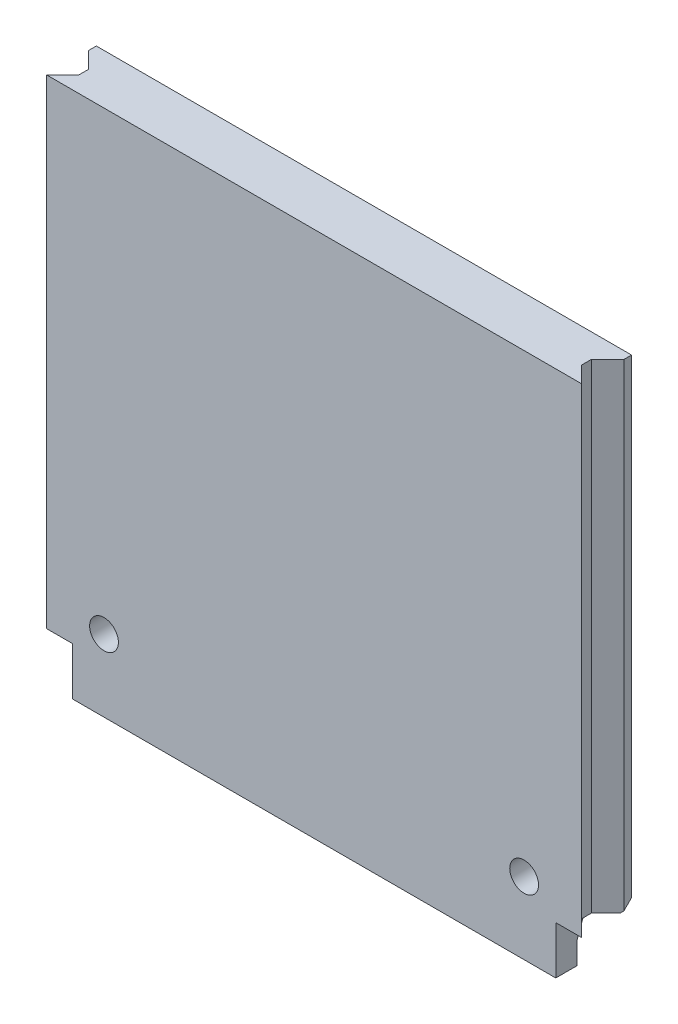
SolidWorks part; units mm, degrees
ref_plane "Alzado" through (0, 0, 0) normal (0, 0, 1) x (1, 0, 0)
ref_plane "Planta" through (0, 0, 0) normal (0, 1, 0) x (1, 0, 0)
ref_plane "Vista lateral" through (0, 0, 0) normal (1, 0, 0) x (0, 0, -1)
sketch "Sketch2" plane through (0, 0, 0) normal (0, 1, 0) x (1, 0, 0)
  line L0 (-60.5836, 0) -> (27.3127, 0) construction
  line L1 (-27.9, -2.2) -> (27.9, -2.2)
  line L2 (-28.8873, 0.5) -> (27.3127, 0.5) construction
  line L3 (-28.4873, -0.5) -> (28.5, -0.5) construction
  line L4 (-27.9, -2.2) -> (-26.2, -0.5)
  line L5 (-26.2, -0.5) -> (-26.2, 0.5)
  line L6 (-26.2, 0.5) -> (-27.9, 2.2)
  line L7 (-27.9, -2.2) -> (-27.9, -1.7267) construction
  line L8 (-27.9, 2.2) -> (-27.9, 3)
  line L9 (-27.9, 3) -> (27.9, 3)
  line L10 (0, -2.2) -> (0, 3) construction
  line L11 (0, 0) -> (0, 5.7662) construction
  line L12 (27.9, -2.2) -> (26.2, -0.5)
  line L13 (26.2, -0.5) -> (26.2, 0.5)
  line L14 (26.2, 0.5) -> (27.9, 2.2)
  line L15 (27.9, 2.2) -> (27.9, 3)
  dimension "D1" = 27.9
  dimension "D2" = 0.5
  dimension "D3" = 0.5
  dimension "D4" = 45
  dimension "D5" = 1.7
  dimension "D6" = 2.5
  dimension "D7" = 1.7
extrude "Boss-Extrude1" add sketch "Sketch2" along normal blind 50
chamfer "Chamfer1" distance 1 angle 45 1 edges at (0, 0, -3)
sketch "Sketch3" plane through (0, 0, 0) normal (0, -1, 0) x (1, 0, 0)
  line L0 (0, -3) -> (0, 2.2) construction
  line L1 (27.9, -3) -> (-27.9, -3) construction
  line L2 (-27.9, 2.2) -> (27.9, 2.2) construction
  line L3 (-25.2023, 2.2) -> (25.2, 2.2)
  line L4 (25.2, 2.2) -> (25.2, -1)
  line L5 (25.2, -1) -> (-25.2023, -1)
  line L6 (-25.2023, -1) -> (-25.2023, 2.2)
  line L7 (-26.2, -0.5) -> (-26.2, 0.5) construction
  line L8 (26.2, 0.5) -> (26.2, -0.5) construction
  point P12 (-26.2, 0)
  dimension "D1" = 0.9977
  dimension "D2" = 1
  dimension "D3" = 2
extrude "Boss-Extrude2" add sketch "Sketch3" along normal blind 5
sketch "Sketch4" plane through (-25.2023, 0, 0) normal (-1, 0, 0) x (0, 0, 1)
  line L0 (-1, 0) -> (0, -2.7475)
  line L1 (0, -2.7475) -> (0, -5)
  line L2 (2.2, -5) -> (-1, -5) construction
  line L3 (0, -5) -> (-1, -5)
  line L4 (-1, -5) -> (-1, 0)
  dimension "D1" = 20
extrude "Cut-Extrude1" cut sketch "Sketch4" against normal through all
sketch "Sketch5" plane through (0, 0, -3) normal (0, 0, -1) x (-1, 0, 0)
  line L0 (-27.9, 6) -> (27.9, 6) construction
  line L1 (-27.9, 50) -> (-27.9, 1) construction
  line L2 (27.9, 50) -> (27.9, 1) construction
  line L3 (-27.9, 1) -> (27.9, 1) construction
  line L4 (-27.9, 2.5) -> (27.9, 2.5) construction
  line L5 (0, 0) -> (0, 50) construction
  line L6 (27.7, 0) -> (-27.7, 0) construction
  line L7 (-27.9, 50) -> (27.9, 50) construction
  circle A0 centre (-21.9, 2.5) radius 1.5
  circle A1 centre (21.9, 2.5) radius 1.5
  dimension "D2" = 3.5
  dimension "D3" = 3
  dimension "D1" = 5
  dimension "D4" = 6
extrude "Cut-Extrude2" cut sketch "Sketch5" against normal through all
